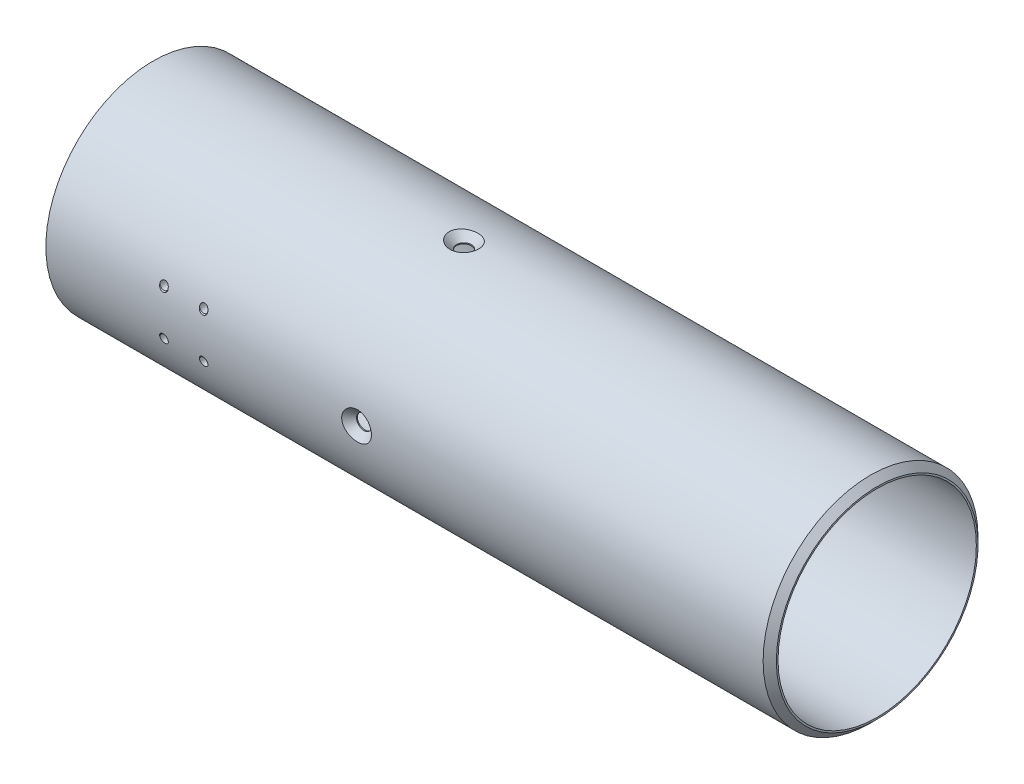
SolidWorks part; units mm, degrees
ref_plane "Face" through (0, 0, 0) normal (0, 0, 1) x (1, 0, 0)
ref_plane "Dessus" through (0, 0, 0) normal (0, 1, 0) x (1, 0, 0)
ref_plane "Droite" through (0, 0, 0) normal (1, 0, 0) x (0, 0, -1)
sketch "Esquisse1" plane through (0, 0, 0) normal (0, 0, 1) x (1, 0, 0)
  line L0 (0, 0) -> (-81.833, 0) construction
  line L1 (-104, 30.5) -> (-104, 32.5)
  line L2 (-104, 32.5) -> (0, 32.5)
  line L3 (0, 32.5) -> (0, 30)
  line L4 (0, 30) -> (-88, 30)
  line L5 (-88, 30) -> (-88, 30.5)
  line L6 (-88, 30.5) -> (-104, 30.5)
  dimension "D1" = 60
  dimension "D2" = 61
  dimension "D3" = 65
  dimension "D4" = 16
  dimension "D5" = 104
revolve "Révolution1" add sketch "Esquisse1" angle 360 about L0
ref_plane "Plan1" through (0, 0, 32.5) normal (0, 0, 1) x (1, 0, 0)
hole_wizard "Fraisage pour vis à tête fraisée à 6 pans creux M41" positions "Esquisse4" profile "Esquisse3" countersink size "M4" standard "DIN"
sketch "Esquisse4" plane through (0, 0, 32.5) normal (0, 0, 1) x (1, 0, 0)
  point P0 (-10, 0)
  dimension "D1" = 10
sketch "Esquisse3" plane through (-10, 0, 32.5) normal (1, 0, 0) x (0, -1, 0)
  line L0 (0, 0) -> (0, 13.3519)
  line L1 (0, 13.3519) -> (2.25, 12)
  line L2 (2.25, 12) -> (2.25, 2.25)
  line L3 (2.25, 2.25) -> (4.5, 0)
  line L5 (4.5, 0) -> (0, 0)
  line L6 (-2.25, 2.25) -> (-4.5, 0) construction
  line L10 (0, 13.3519) -> (-2.25, 12) construction
  line L11 (0, -6.35) -> (0, 107.95) construction
  dimension "Diamètre du perçage" = 4.5
  dimension "Profondeur du perçage" = 12
  dimension "Diamètre du fraisage entrant" = 9
  dimension "Angle du fraisage entrant" = 90
  dimension "Angle de pointe" = 118
ref_axis "Axe1" through (-88, 0, 0) along (1, 0, 0)
pattern_circular "Répétition circulaire1" count 4 over 360 about axis through (-88, 0, 0) along (1, 0, 0) of "Fraisage pour vis à tête fraisée à 6 pans creux M41"
sketch "Esquisse5" plane through (0, 0, 0) normal (1, 0, 0) x (0, 0, -1)
  circle A0 centre (0, 0) radius 30 construction
  circle A1 centre (0, 0) radius 32.5
  circle A2 centre (0, 0) radius 32.5
  circle A3 centre (0, 0) radius 30
  dimension "D1" = 0
extrude "Extrusion1" add sketch "Esquisse5" along normal blind 115
hole_wizard "Trou taraudé M3x0.51" positions "Esquisse8" profile "Esquisse7" tap size "M3x0.5" standard "DIN"
sketch "Esquisse8" plane through (0, 0, 32.5) normal (0, 0, 1) x (1, 0, 0)
  line L0 (-104, 32.5) -> (-104, -32.5) construction
  point P0 (-69, 7)
  point P1 (-69, -7)
  point P2 (-57, -7)
  point P3 (-57, 7)
  dimension "D1" = 35
  dimension "D2" = 12
  dimension "D3" = 7
  dimension "D4" = 7
sketch "Esquisse7" plane through (-69, 7, 32.5) normal (1, 0, 0) x (0, -1, 0)
  line L0 (0, 0) -> (0, 8.2217)
  line L1 (0, 8.2217) -> (1.25, 7.5)
  line L2 (1.25, 7.5) -> (1.25, 0.75)
  line L3 (1.25, 0.75) -> (2, 0)
  line L5 (2, 0) -> (0, 0)
  line L6 (-1.25, 0.75) -> (-2, 0) construction
  line L10 (0, 8.2217) -> (-1.25, 7.5) construction
  line L11 (0, -6.35) -> (0, 107.95) construction
  dimension "Diamètre du trou pour taraudage" = 2.5
  dimension "Profondeur du trou pour taraudage" = 7.5
  dimension "Diamètre du fraisage entrant" = 4
  dimension "Angle du fraisage entrant" = 90
  dimension "Angle de pointe" = 120
chamfer "Chanfrein1" distance 2 angle 45 1 edges at (115, 0, -32.5)
